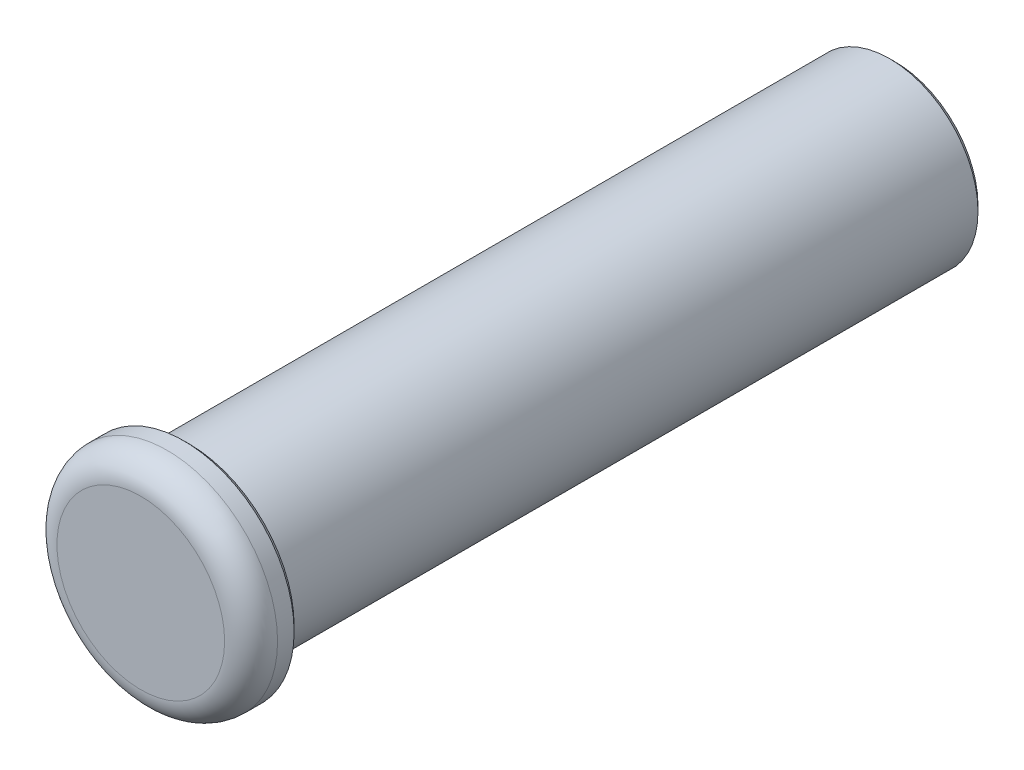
SolidWorks part; units mm, degrees
ref_plane "Спереди" through (0, 0, 0) normal (0, 0, 1) x (1, 0, 0)
ref_plane "Сверху" through (0, 0, 0) normal (0, 1, 0) x (1, 0, 0)
ref_plane "Справа" through (0, 0, 0) normal (1, 0, 0) x (0, 0, -1)
sketch "Эскиз1" plane through (0, 0, 0) normal (1, 0, 0) x (0, 0, -1)
  line L0 (0, 0) -> (0, 4)
  line L1 (0, 4) -> (-32, 4)
  line L2 (-32, 4) -> (-32, 5)
  line L3 (-32, 5) -> (-33, 5)
  line L4 (-34.2, 3.8) -> (-34.2, 0)
  line L5 (-34.2, 0) -> (0, 0)
  arc A0 (-33, 5) -> (-34.2, 3.8) centre (-33, 3.8) ccw
  dimension "D5" = 1.2
  dimension "D1" = 4
  dimension "D2" = 32
  dimension "D3" = 2.2
  dimension "D4" = 5
revolve "Повернуть1" add sketch "Эскиз1" angle 360 about L5
chamfer "Фаска1" distance 0.25 angle 45 3 edges at (4, 0, 32) (5, 0, 32) (4, 0, 0)
